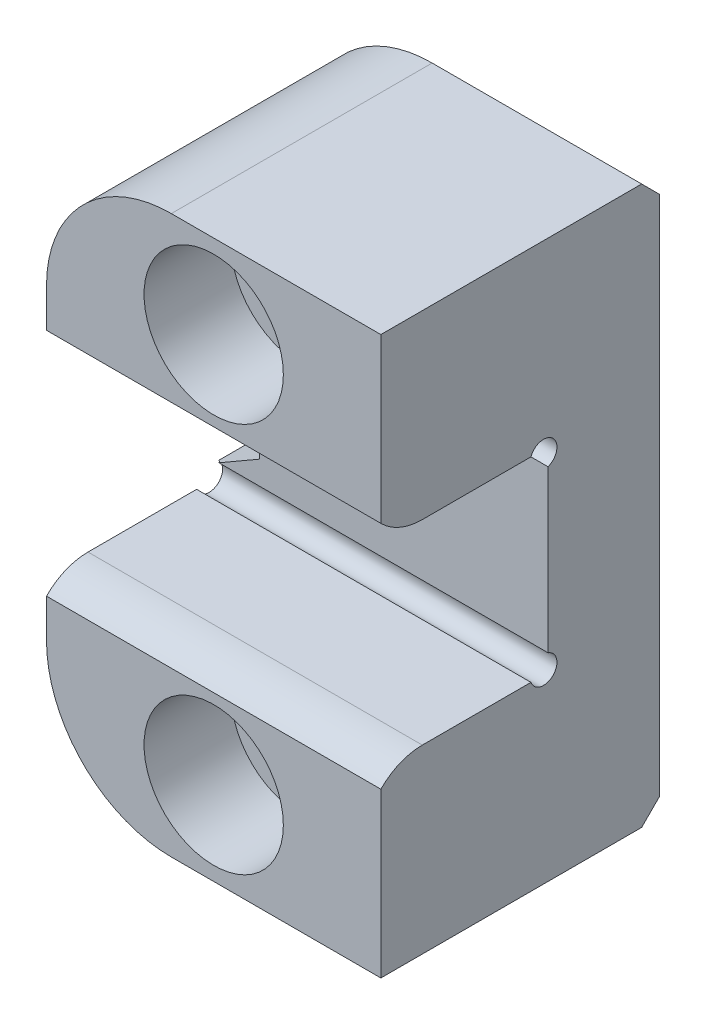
SolidWorks part; units mm, degrees
ref_plane "Front Plane" through (0, 0, 0) normal (0, 0, 1) x (1, 0, 0)
ref_plane "Top Plane" through (0, 0, 0) normal (0, 1, 0) x (1, 0, 0)
ref_plane "Right Plane" through (0, 0, 0) normal (1, 0, 0) x (0, 0, -1)
sketch "Sketch1" plane through (0, 0, 0) normal (1, 0, 0) x (0, 0, -1)
  line L0 (0, 0) -> (50000, 0) construction
  line L1 (0, 5.5626) -> (9.525, 5.5626)
  line L2 (0, 15.875) -> (15.875, 15.875)
  line L3 (0, 15.875) -> (0, 5.5626)
  line L4 (0, -15.875) -> (15.875, -15.875)
  line L5 (15.875, 15.875) -> (15.875, -15.875)
  line L6 (9.525, 5.5626) -> (9.525, -5.5626)
  line L7 (9.525, -5.5626) -> (0, -5.5626)
  line L9 (0, 11) -> (0, -11) construction
  line L10 (0, -5.5626) -> (0, -15.875)
  dimension "D1" = 15.875
  dimension "D2" = 31.75
  dimension "D3" = 9.525
  dimension "D4" = 11.1252
extrude "Extrude1" add sketch "Sketch1" along normal mid plane 19.05
fillet "Fillet1" radius 7.112 2 edges at (-9.525, -15.875, -7.9375) (-9.525, 15.875, -7.9375)
sketch "Sketch2" plane through (-6.35, 0, -15.875) normal (0, 0, 1) x (1, 0, 0)
  line L0 (0, 0) -> (50000, 0) construction
  line L1 (15.875, -15.875) -> (15.875, 15.875) construction
  line L2 (14.2875, 3.846) -> (17.4625, 5.679) construction
  line L3 (14.2875, 3.846) -> (14.2875, -3.846) construction
  line L4 (14.2875, -3.846) -> (17.4625, -5.679) construction
  line L5 (17.4625, 5.679) -> (17.4625, -5.679) construction
  line L6 (6.35, 0) -> (6.35, 50000) construction
  line L7 (-4.7625, 5.679) -> (-4.7625, -5.679)
  line L8 (-1.5875, -3.846) -> (-4.7625, -5.679)
  line L9 (-1.5875, 3.846) -> (-1.5875, -3.846)
  line L10 (-1.5875, 3.846) -> (-4.7625, 5.679)
  point P4 (15.875, 4.7625)
  point P10 (15.875, -4.7625)
  point P13 (-3.175, -4.7625)
  point P14 (-3.175, 4.7625)
  dimension "D1" = 9.525
  dimension "D2" = 1.5875
  dimension "D3" = 30
  dimension "D4" = 3.175
extrude "Cut-Extrude1" cut sketch "Sketch2" along normal through all
sketch "Sketch5" plane through (9.525, 0, 0) normal (1, 0, 0) x (0, 0, -1)
  line L0 (0, 0) -> (50000, 0) construction
  line L2 (0, 15.875) -> (0, 5.5626) construction
  line L3 (0, -5.5626) -> (0, -15.875) construction
  line L4 (-3.9878, -3.3836) -> (2.3622, -3.3836)
  line L5 (-3.9878, -3.3836) -> (-3.9878, -6.5586)
  line L6 (-3.9878, -6.5586) -> (0, -6.5586)
  line L7 (2.3622, -3.3836) -> (2.3622, -5.5626)
  line L8 (9.525, -5.5626) -> (0, -5.5626) construction
  line L9 (2.3622, 3.3836) -> (2.3622, 5.5626)
  line L10 (-3.9878, 6.5586) -> (0, 6.5586)
  line L11 (-3.9878, 3.3836) -> (-3.9878, 6.5586)
  line L12 (-3.9878, 3.3836) -> (2.3622, 3.3836)
  line L13 (0, 5.5626) -> (9.525, 5.5626) construction
  arc A0 (0.5438, -5.8285) -> (2.3622, -5.5626) centre (2.3622, -11.9126) cw construction
  arc A1 (0, -6.5586) -> (0.5438, -5.8285) centre (0.762, -6.5586) cw construction
  arc A2 (0, 6.5586) -> (0.5438, 5.8285) centre (0.762, 6.5586) ccw construction
  arc A3 (0.5438, 5.8285) -> (2.3622, 5.5626) centre (2.3622, 11.9126) ccw construction
  arc A4 (0, 6.5586) -> (2.3622, 5.5626) centre (2.3622, 8.8618) ccw
  arc A5 (0, -6.5586) -> (2.3622, -5.5626) centre (2.3622, -8.8618) cw
  dimension "D1" = 0.762
  dimension "D2" = 6.35
  dimension "D3" = 3.175
  dimension "D4" = 6.35
  dimension "D5" = 2.3622
extrude "Cut-Extrude2" cut sketch "Sketch5" against normal through all
sketch "Sketch6" plane through (9.525, 0, 0) normal (1, 0, 0) x (0, 0, -1)
  line L0 (0, 0) -> (50000, 0) construction
  line L3 (9.525, 5.5626) -> (9.525, -5.5626) construction
  line L4 (2.3622, 5.5626) -> (9.525, 5.5626) construction
  circle A0 centre (9.271, 5.3086) radius 0.762
  circle A1 centre (9.271, -5.3086) radius 0.762
  dimension "D2" = 0.508
  dimension "D3" = 0.762
  dimension "D1" = 0.508
extrude "Cut-Extrude3" cut sketch "Sketch6" against normal through all
hole_wizard "#8 CBORE" positions "Sketch4" profile "Sketch3" counterbore size "#8" standard "Ansi Inch"
sketch "Sketch4" plane through (0, 0, 0) normal (0, 0, 1) x (1, 0, 0)
  line L0 (0, 0) -> (0, 50000) construction
  line L1 (0, 0) -> (50000, 0) construction
  point P0 (0, 11.1125)
  point P12 (0, -11.1125)
  dimension "D1" = 22.225
sketch "Sketch3" plane through (0, 11.1125, 0) normal (1, 0, 0) x (0, -1, 0)
  line L0 (0, 0) -> (0, 15.875)
  line L1 (0, 15.875) -> (2.4574, 15.875)
  line L3 (2.4574, 15.875) -> (2.4575, 4.9606)
  line L4 (2.4575, 4.9606) -> (3.9687, 4.9606)
  line L5 (3.9687, 4.9606) -> (3.9687, 0)
  line L7 (3.9687, 0) -> (0, 0)
  line L11 (0, -6.35) -> (0, 107.95) construction
  dimension "Thru Hole Dia." = 4.9149
  dimension "Thru Hole Depth" = 15.875
  dimension "C'Bore Dia." = 7.9375
  dimension "C'Bore Depth" = 4.9606
chamfer "Chamfer3" distance 3.81 angle 15 1 edges at (-7.9375, 0, -9.525)
chamfer "Chamfer1" distance 1.016 angle 45 6 edges at (-9.525, -6.7627, -15.875) (-7.4419, -13.7919, -15.875) (3.556, -15.875, -15.875) (3.556, 15.875, -15.875) (-9.525, 6.7628, -15.875) (-7.4419, 13.7919, -15.875)
